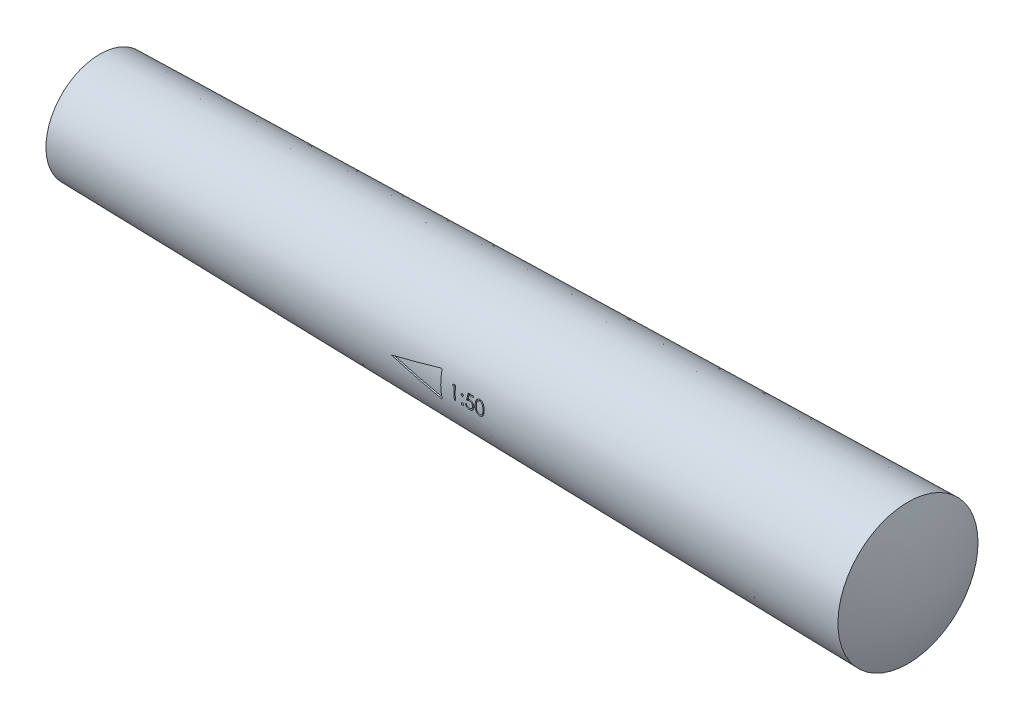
SolidWorks part; units mm, degrees
ref_plane "Front Plane" through (0, 0, 0) normal (0, 0, 1) x (1, 0, 0)
ref_plane "Top Plane" through (0, 0, 0) normal (0, 1, 0) x (1, 0, 0)
ref_plane "Right Plane" through (0, 0, 0) normal (1, 0, 0) x (0, 0, -1)
sketch "Sketch1" plane through (0, 0, 0) normal (1, 0, 0) x (0, 0, -1)
  circle A0 centre (0, 0) radius 4
  dimension "D1" = 8
extrude "Extrude1" add sketch "Sketch1" along normal mid plane 60
draft "Draft1" type of draft neutral plane draft angle 1.146 faces to draft 1 parameters "D1"=1.146
sketch "Sketch2" plane through (0, 0, 0) normal (0, 0, 1) x (1, 0, 0)
  line L0 (-30, 0) -> (-30, 4)
  line L1 (-30, 4) -> (-30, -4) construction
  line L2 (-30, 0) -> (-31, 0)
  line L3 (-31, 0) -> (-31, -4.6) construction
  line L4 (30, 0) -> (30, 5.2)
  line L5 (30, -5.2) -> (30, 5.2) construction
  line L6 (30, 0) -> (31, 0)
  line L7 (31, 0) -> (31, -4.6) construction
  line L8 (-30, -4) -> (30, -5.2) construction
  arc A0 (-31, 0) -> (-30, 4) centre (-22.5, 0) cw
  arc A1 (31, 0) -> (30, 5.2) centre (16.9798, 0) ccw
  point P14 (0, -4.6)
revolve "Revolve1" add sketch "Sketch2" angle 360 about L2
sketch "Sketch5" plane through (0, 0, 0) normal (0, 0, 1) x (1, 0, 0)
  line L0 (0, 4.6) -> (0, -4.6) construction
  line L1 (30, 5.2) -> (-30, 4) construction
  line L2 (-30, -4) -> (30, -5.2) construction
ref_plane "Plane2" through (0, 0, 0) normal (-0.02, 0, 0.9998) x (0.9998, 0, 0.02)
sketch "Sketch6" plane through (0, 0, 0) normal (-0.02, 0, 0.9998) x (0.9998, 0, 0.02)
  line L0 (0, 0) -> (0, 1)
  line L1 (0, 4.6) -> (0, -4.6) construction
  line L2 (0, 1) -> (-3.7321, 0)
  line L3 (-3.7321, 0) -> (0, -1)
  line L4 (0, -1) -> (0, 0)
  line L5 (0, -0.5) -> (4, -0.5) construction
  text T0 "1:50" font "Century Gothic" height 1
  dimension "D1" = 2
  dimension "D2" = 30
  dimension "D3" = 4
wrap "Wrap2" sketch "Sketch6" wrap type deboss source sketch "Sketch6" thickness 0.1 parameters "D1"=0.1
equation "\"D2@Sketch2\" = \"D1@Sketch2\""
